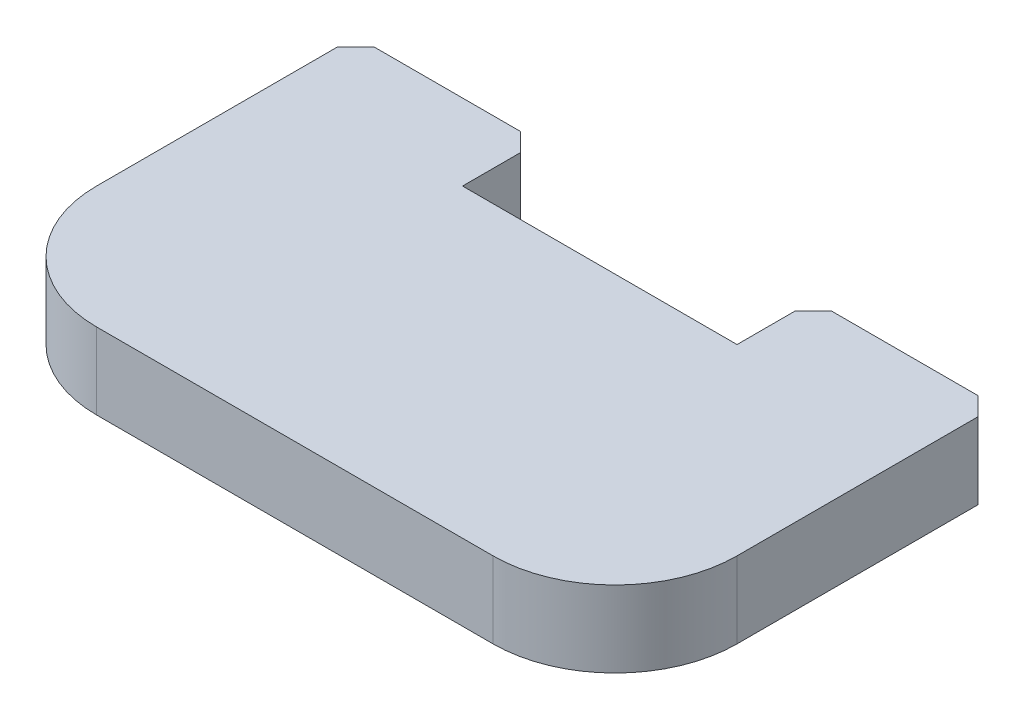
SolidWorks part; units mm, degrees
ref_plane "Front Plane" through (0, 0, 0) normal (0, 0, 1) x (1, 0, 0)
ref_plane "Top Plane" through (0, 0, 0) normal (0, 1, 0) x (1, 0, 0)
ref_plane "Right Plane" through (0, 0, 0) normal (1, 0, 0) x (0, 0, -1)
sketch "Sketch1" plane through (0, 0, 0) normal (0, 1, 0) x (1, 0, 0)
  line L1 (-13.335, 7.9375) -> (13.335, 7.9375)
  line L2 (-13.335, 7.9375) -> (-13.335, -7.9375)
  line L3 (-13.335, -7.9375) -> (13.335, -7.9375)
  line L4 (13.335, 7.9375) -> (13.335, -7.9375)
  line L5 (-13.335, 7.9375) -> (13.335, -7.9375) construction
  line L6 (-13.335, -7.9375) -> (13.335, 7.9375) construction
  point P0 (0, 0)
extrude "Boss-Extrude1" add sketch "Sketch1" along normal blind 3.175
sketch "Sketch2" plane through (0, 3.175, 0) normal (0, 1, 0) x (1, 0, 0)
  line L0 (13.335, 7.9375) -> (-13.335, 7.9375) construction
  line L1 (-5.715, 11.1125) -> (5.715, 11.1125)
  line L2 (-5.715, 11.1125) -> (-5.715, 4.7625)
  line L3 (-5.715, 4.7625) -> (5.715, 4.7625)
  line L4 (5.715, 11.1125) -> (5.715, 4.7625)
  line L5 (-5.715, 11.1125) -> (5.715, 4.7625) construction
  line L6 (-5.715, 4.7625) -> (5.715, 11.1125) construction
  point P0 (0, 7.9375)
extrude "Cut-Extrude1" cut sketch "Sketch2" against normal through all
chamfer "Chamfer1" distance 0.762 4 edges at (13.335, 1.5875, -7.9375) (5.715, 1.5875, -7.9375) (-13.335, 1.5875, -7.9375) (-5.715, 1.5875, -7.9375)
fillet "Fillet1" radius 5.08 2 edges at (13.335, 1.5875, 7.9375) (-13.335, 1.5875, 7.9375)
sketch "Sketch3" plane through (0, 3.175, 0) normal (0, 1, 0) x (1, 0, 0)
  line L24 (-8.255, -8.0391) -> (8.255, -8.0391)
  line L25 (13.4366, -2.8575) -> (13.4366, 7.2176)
  line L26 (13.4366, 7.2176) -> (12.6151, 8.0391)
  line L27 (12.6151, 8.0391) -> (6.4349, 8.0391)
  line L28 (6.4349, 8.0391) -> (5.6134, 7.2176)
  line L29 (5.6134, 7.2176) -> (5.6134, 4.8641)
  line L30 (5.6134, 4.8641) -> (-5.6134, 4.8641)
  line L31 (-5.6134, 4.8641) -> (-5.6134, 7.2176)
  line L32 (-5.6134, 7.2176) -> (-6.4349, 8.0391)
  line L33 (-6.4349, 8.0391) -> (-12.6151, 8.0391)
  line L34 (-12.6151, 8.0391) -> (-13.4366, 7.2176)
  line L35 (-13.4366, 7.2176) -> (-13.4366, -2.8575)
  line L36 (-8.255, -8.0391) -> (8.255, -8.0391)
  line L37 (13.4366, -2.8575) -> (13.4366, 7.2176)
  line L38 (13.4366, 7.2176) -> (12.6151, 8.0391)
  line L39 (12.6151, 8.0391) -> (6.4349, 8.0391)
  line L40 (6.4349, 8.0391) -> (5.6134, 7.2176)
  line L41 (5.6134, 7.2176) -> (5.6134, 4.8641)
  line L42 (5.6134, 4.8641) -> (-5.6134, 4.8641)
  line L43 (-5.6134, 4.8641) -> (-5.6134, 7.2176)
  line L44 (-5.6134, 7.2176) -> (-6.4349, 8.0391)
  line L45 (-6.4349, 8.0391) -> (-12.6151, 8.0391)
  line L46 (-12.6151, 8.0391) -> (-13.4366, 7.2176)
  line L47 (-13.4366, 7.2176) -> (-13.4366, -2.8575)
  arc A4 (8.255, -8.0391) -> (13.4366, -2.8575) centre (8.255, -2.8575) ccw
  arc A5 (-13.4366, -2.8575) -> (-8.255, -8.0391) centre (-8.255, -2.8575) ccw
  arc A6 (8.255, -8.0391) -> (13.4366, -2.8575) centre (8.255, -2.8575) ccw
  arc A7 (-13.4366, -2.8575) -> (-8.255, -8.0391) centre (-8.255, -2.8575) ccw
equation "\"D1@Sketch1\"=2*(.375+.300/2)"
equation "\"D2@Sketch1\"=.5 + \"t\""
equation "\"D1@Boss-Extrude1\"=\"t\""
equation "\"t\"= .125'plywood thickness"
equation "\"D1@Sketch2\"=2*(.375-.3/2)"
equation "\"D2@Sketch2\"=\"t\"*2"
equation "\"kerf\"= .004in'Kerf for laser cutter"
equation "\"D1@Sketch3\"=\"kerf\""
